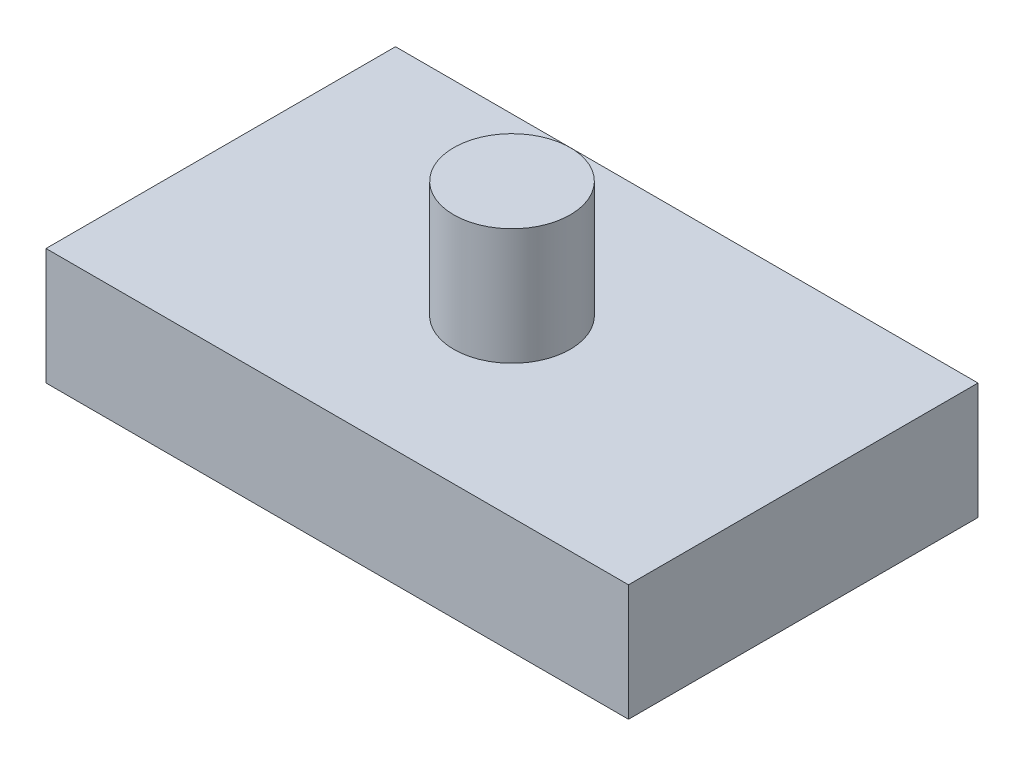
SolidWorks part; units mm, degrees
ref_plane "正面" through (0, 0, 0) normal (0, 0, 1) x (1, 0, 0)
ref_plane "平面" through (0, 0, 0) normal (0, 1, 0) x (1, 0, 0)
ref_plane "右側面" through (0, 0, 0) normal (1, 0, 0) x (0, 0, -1)
sketch "ｽｹｯﾁ1" plane through (0, 0, 0) normal (0, 1, 0) x (1, 0, 0)
  line L1 (-25, -15) -> (25, -15)
  line L2 (-25, -15) -> (-25, 15)
  line L3 (-25, 15) -> (25, 15)
  line L4 (25, -15) -> (25, 15)
  line L5 (-25, -15) -> (25, 15) construction
  line L6 (-25, 15) -> (25, -15) construction
  point P0 (0, 0)
  dimension "D1" = 50
  dimension "D2" = 30
extrude "ﾎﾞｽ - 押し出し1" add sketch "ｽｹｯﾁ1" along normal blind 10
sketch "ｽｹｯﾁ2" plane through (0, 10, 0) normal (0, 1, 0) x (1, 0, 0)
  circle A0 centre (0, 0) radius 5
  dimension "D1" = 10
extrude "ﾎﾞｽ - 押し出し2" add sketch "ｽｹｯﾁ2" along normal blind 10
